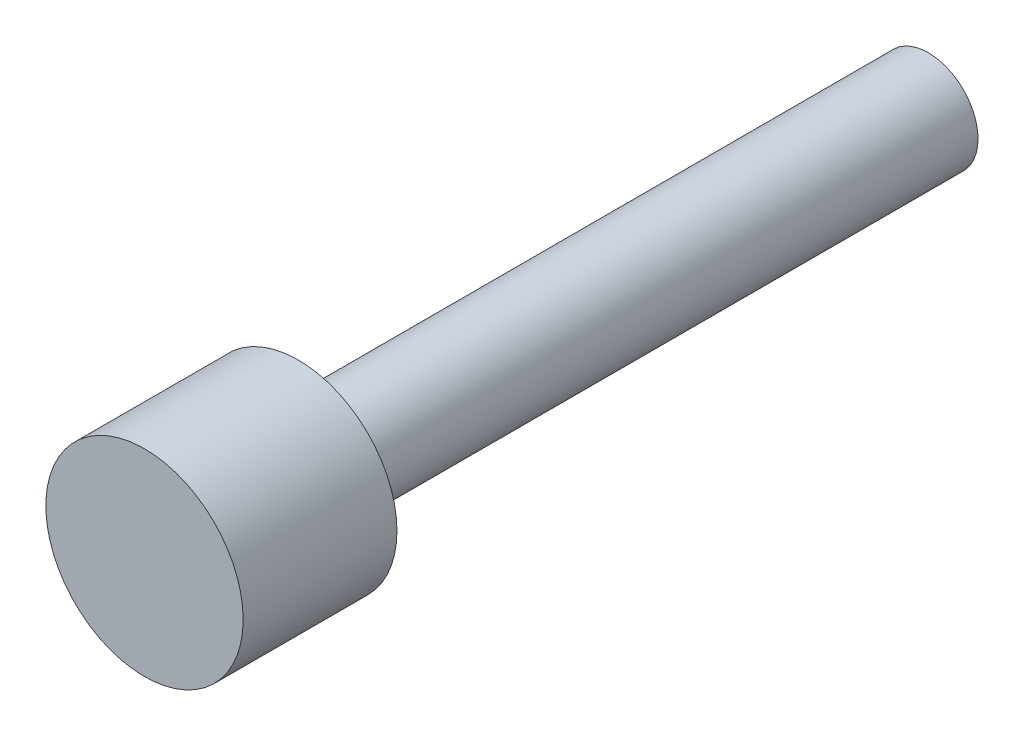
SolidWorks part; units mm, degrees
ref_plane "Front Plane" through (0, 0, 0) normal (0, 0, 1) x (1, 0, 0)
ref_plane "Top Plane" through (0, 0, 0) normal (0, 1, 0) x (1, 0, 0)
ref_plane "Right Plane" through (0, 0, 0) normal (1, 0, 0) x (0, 0, -1)
sketch "Sketch1" plane through (0, 0, 0) normal (0, 0, 1) x (1, 0, 0)
  circle A0 centre (0, 0) radius 7.1438
extrude "Boss-Extrude1" add sketch "Sketch1" against normal up to surface (11.1347 mm away)
sketch "Sketch2" plane through (0, 0, -11.1347) normal (0, 0, -1) x (-1, 0, 0)
  circle A0 centre (0, 0) radius 3.5954
  dimension "D1" = 7.1907
extrude "Boss-Extrude2" add sketch "Sketch2" along normal up to surface (45.6184 mm away)
